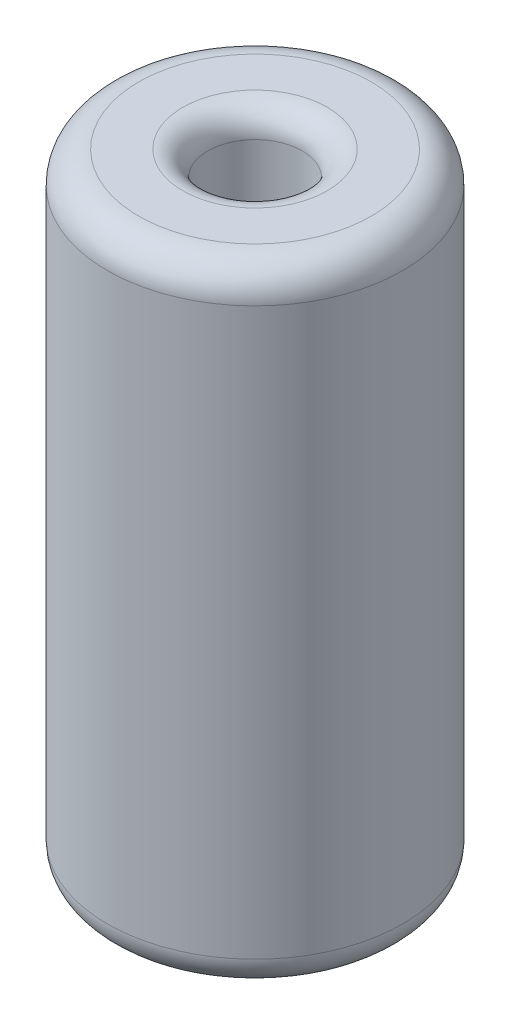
SolidWorks part; units mm, degrees
ref_plane "Front Plane" through (0, 0, 0) normal (0, 0, 1) x (1, 0, 0)
ref_plane "Top Plane" through (0, 0, 0) normal (0, 1, 0) x (1, 0, 0)
ref_plane "Right Plane" through (0, 0, 0) normal (1, 0, 0) x (0, 0, -1)
sketch "Sketch1" plane through (0, 0, 0) normal (0, 0, 1) x (1, 0, 0)
  line L0 (0, 0) -> (0, 10.5043) construction
  line L2 (1.15, 10) -> (1.85, 10)
  line L3 (0.75, 9.6) -> (0.75, 0.4)
  line L4 (1.15, 0) -> (1.85, 0)
  line L5 (2.35, 9.5) -> (2.35, 0.5)
  arc A0 (1.85, 0) -> (2.35, 0.5) centre (1.85, 0.5) ccw
  arc A1 (2.35, 9.5) -> (1.85, 10) centre (1.85, 9.5) ccw
  arc A2 (1.15, 0) -> (0.75, 0.4) centre (1.15, 0.4) cw
  arc A3 (0.75, 9.6) -> (1.15, 10) centre (1.15, 9.6) cw
  point P9 (2.35, 0)
  point P12 (2.35, 10)
  dimension "D4" = 0.5
  dimension "D5" = 0.4
  dimension "D1" = 1.5
  dimension "D2" = 4.7
  dimension "D3" = 10
revolve "Revolve1" add sketch "Sketch1" angle 360 about L0
